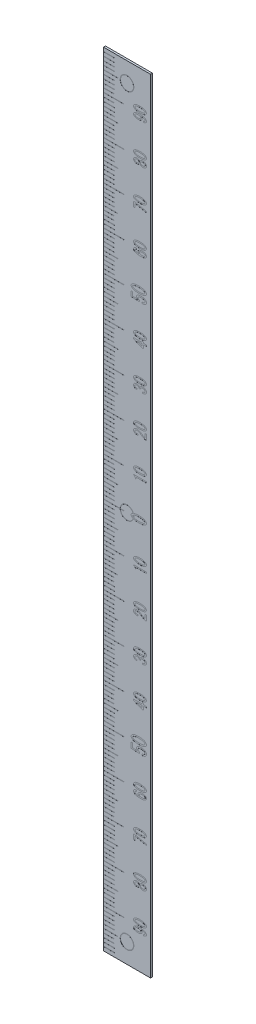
SolidWorks part; units mm, degrees
ref_plane "Front" through (0, 0, 0) normal (0, 0, 1) x (1, 0, 0)
ref_plane "Top" through (0, 0, 0) normal (0, 1, 0) x (1, 0, 0)
ref_plane "Right" through (0, 0, 0) normal (1, 0, 0) x (0, 0, -1)
sketch "Sketch1" plane through (0, 0, 0) normal (0, 0, 1) x (1, 0, 0)
  line L1 (0, 0) -> (0, 200)
  line L2 (0, 0) -> (12, 0)
  line L3 (12, 0) -> (12, 200)
  line L4 (0, 200) -> (12, 200)
  dimension "D1" = 200
  dimension "D2" = 12
extrude "Extrude1" add sketch "Sketch1" along normal blind 0.5
sketch "Sketch2" plane through (0, 0, 0.5) normal (0, 0, 1) x (1, 0, 0)
  line L0 (0, 200) -> (0, 0) construction
  line L1 (0, 0) -> (12, 0) construction
  line L2 (12, 200) -> (0, 200) construction
  circle A0 centre (6, 5) radius 1.75
  circle A1 centre (6, 195) radius 1.75
  circle A2 centre (6, 5) radius 1.65
  circle A3 centre (6, 195) radius 1.65
  circle A4 centre (6, 100) radius 1.75
  circle A5 centre (6, 100) radius 1.65
  dimension "D1" = 6
  dimension "D2" = 6
  dimension "D3" = 5
  dimension "D4" = 5
  dimension "D5" = 3.5
  dimension "D6" = 3.5
  dimension "D7" = 0.1
  dimension "D8" = 2
extrude "Extrude2" cut sketch "Sketch2" against normal blind 0.01
sketch "Sketch3" plane through (0, 0, 0.5) normal (0, 0, 1) x (1, 0, 0)
  line L0 (7.5, 188.25) -> (11, 188.25) construction
  line L1 (7.5, 138.25) -> (11, 138.25) construction
  line L2 (7.5, 138.25) -> (7.5, 141.75) construction
  line L3 (7.5, 141.75) -> (11, 141.75) construction
  line L4 (11, 138.25) -> (11, 141.75) construction
  line L6 (11, 128.25) -> (11, 131.75) construction
  line L7 (11, 118.25) -> (11, 121.75) construction
  line L8 (11, 108.25) -> (11, 111.75) construction
  line L9 (11, 97.2) -> (11, 102.8) construction
  line L10 (11, 88.25) -> (11, 91.75) construction
  line L11 (11, 78.25) -> (11, 81.75) construction
  line L12 (11, 68.25) -> (11, 71.75) construction
  line L13 (11, 58.25) -> (11, 61.75) construction
  line L14 (11, 48) -> (11, 52) construction
  line L15 (11, 38.25) -> (11, 43.5) construction
  line L16 (11, 110) -> (-4.9003, 110) construction
  line L17 (11, 50) -> (-4.9003, 50) construction
  line L18 (11, 28.25) -> (11, 33.5) construction
  line L19 (11, 18.25) -> (11, 23.5) construction
  line L20 (11, 8.25) -> (11, 13.5) construction
  line L21 (11, 100) -> (-4.9003, 100) construction
  line L22 (11, 120) -> (-4.9003, 120) construction
  line L23 (11, 130) -> (-4.9003, 130) construction
  line L24 (11, 140) -> (-4.9003, 140) construction
  line L25 (7.5, 188.25) -> (7.5, 191.75) construction
  line L26 (7.5, 191.75) -> (11, 191.75) construction
  line L27 (11, 188.25) -> (11, 191.75) construction
  line L28 (11, 178.25) -> (11, 181.75) construction
  line L29 (11, 168.25) -> (11, 171.75) construction
  line L30 (11, 158.25) -> (11, 161.75) construction
  line L31 (11, 148) -> (11, 152.8) construction
  line L32 (4.5, 160) -> (-4.9003, 160) construction
  line L33 (4.5, 150) -> (-4.9003, 150) construction
  line L34 (4.5, 170) -> (-4.9003, 170) construction
  line L35 (4.5, 180) -> (-4.9003, 180) construction
  line L36 (4.5, 190) -> (-4.9003, 190) construction
  line L37 (11, 40) -> (-4.9003, 40) construction
  line L38 (11, 30) -> (-4.9003, 30) construction
  line L39 (11, 20) -> (-4.9003, 20) construction
  line L40 (11, 10) -> (-4.9003, 10) construction
  line L41 (12, 0) -> (12, 200) construction
  line L42 (11, 90) -> (-4.9003, 90) construction
  text T0 "40" font "ＭＳ ゴシック" height in points 11
  text T1 "30" font "ＭＳ ゴシック" height in points 11
  text T2 "20" font "ＭＳ ゴシック" height in points 11
  text T3 "10" font "ＭＳ ゴシック" height in points 11
  text T4 " 0 " font "ＭＳ ゴシック" height in points 13
  text T5 "10" font "ＭＳ ゴシック" height in points 11
  text T6 "20" font "ＭＳ ゴシック" height in points 11
  text T7 "30" font "ＭＳ ゴシック" height in points 11
  text T8 "40" font "ＭＳ ゴシック" height in points 11
  text T9 "50" font "ＭＳ ゴシック" height in points 13
  text T10 "60" font "ＭＳ ゴシック" height in points 11
  text T11 "70" font "ＭＳ ゴシック" height in points 11
  text T12 "80" font "ＭＳ ゴシック" height in points 11
  text T13 "90" font "ＭＳ ゴシック" height in points 11
  text T14 "50" font "ＭＳ ゴシック" height in points 13
  text T15 "60" font "ＭＳ ゴシック" height in points 11
  text T16 "70" font "ＭＳ ゴシック" height in points 11
  text T17 "80" font "ＭＳ ゴシック" height in points 11
  text T18 "90" font "ＭＳ ゴシック" height in points 11
  point P19 (11, 100)
  dimension "D1" = 3.5
  dimension "D2" = 1.75
  dimension "D4" = 3.5
  dimension "D8" = 4
  dimension "D9" = 50
  dimension "D10" = 2
  dimension "D11" = 5.6
  dimension "D12" = 1.75
  dimension "D5" = 3.5
  dimension "D13" = 1.75
  dimension "D14" = 1.75
  dimension "D15" = 1
  dimension "D16" = 1.75
  dimension "D17" = 1.75
  dimension "D18" = 1.75
  dimension "D19" = 1.75
  dimension "D20" = 1
  dimension "D21" = 1
  dimension "D23" = 1.75
  dimension "D24" = 2
  dimension "D25" = 1.75
  dimension "D26" = 1.75
  dimension "D27" = 1.75
  dimension "D28" = 1.75
  dimension "D29" = 1
  dimension "D6" = 5
  dimension "D7" = 5
  dimension "D22" = 2
extrude "Extrude3" cut sketch "Sketch3" against normal blind 0.01
sketch "Sketch4" plane through (0, 0, 0.5) normal (0, 0, 1) x (1, 0, 0)
  line L806 (5.8733, 199.8158) -> (5.8733, 186.95) construction
  line L807 (2.7465, 1.05) -> (2.7465, 0.95)
  line L808 (-0.2535, 0.95) -> (2.7465, 0.95)
  line L809 (-0.2535, 1.05) -> (2.7465, 1.05)
  line L810 (-0.2535, 1.05) -> (-0.2535, 0.95)
  line L811 (2.7465, 2.05) -> (2.7465, 1.95)
  line L812 (-0.2535, 1.95) -> (2.7465, 1.95)
  line L813 (-0.2535, 2.05) -> (2.7465, 2.05)
  line L814 (-0.2535, 2.05) -> (-0.2535, 1.95)
  line L815 (2.7465, 3.05) -> (2.7465, 2.95)
  line L816 (-0.2535, 2.95) -> (2.7465, 2.95)
  line L817 (-0.2535, 3.05) -> (2.7465, 3.05)
  line L818 (-0.2535, 3.05) -> (-0.2535, 2.95)
  line L819 (2.7465, 4.05) -> (2.7465, 3.95)
  line L820 (-0.2535, 3.95) -> (2.7465, 3.95)
  line L821 (-0.2535, 4.05) -> (2.7465, 4.05)
  line L822 (-0.2535, 4.05) -> (-0.2535, 3.95)
  line L823 (2.7465, 6.05) -> (2.7465, 5.95)
  line L824 (-0.2535, 5.95) -> (2.7465, 5.95)
  line L825 (-0.2535, 6.05) -> (2.7465, 6.05)
  line L826 (-0.2535, 6.05) -> (-0.2535, 5.95)
  line L827 (2.7465, 7.05) -> (2.7465, 6.95)
  line L828 (-0.2535, 6.95) -> (2.7465, 6.95)
  line L829 (-0.2535, 7.05) -> (2.7465, 7.05)
  line L830 (-0.2535, 7.05) -> (-0.2535, 6.95)
  line L831 (2.7465, 8.05) -> (2.7465, 7.95)
  line L832 (-0.2535, 7.95) -> (2.7465, 7.95)
  line L833 (-0.2535, 8.05) -> (2.7465, 8.05)
  line L834 (2.7465, 9.05) -> (2.7465, 8.95)
  line L835 (-0.2535, 8.95) -> (2.7465, 8.95)
  line L836 (-0.2535, 9.05) -> (-0.2535, 8.95)
  line L837 (-0.2535, 9.05) -> (2.7465, 9.05)
  line L838 (3.7465, 4.95) -> (3.7465, 5.05)
  line L839 (-0.2535, 5.05) -> (3.7465, 5.05)
  line L840 (-0.2535, 4.95) -> (-0.2535, 5.05)
  line L841 (-0.2535, 4.95) -> (3.7465, 4.95)
  line L842 (-0.2535, 8.05) -> (-0.2535, 7.95)
  line L843 (-0.2535, 9.95) -> (-0.2535, 10.05)
  line L844 (5.2465, 9.95) -> (-0.2535, 9.95)
  line L845 (5.2465, 10.05) -> (5.2465, 9.95)
  line L846 (-0.2535, 10.05) -> (5.2465, 10.05)
  line L847 (2.7465, 11.05) -> (2.7465, 10.95)
  line L848 (-0.2535, 10.95) -> (2.7465, 10.95)
  line L849 (-0.2535, 11.05) -> (2.7465, 11.05)
  line L850 (-0.2535, 11.05) -> (-0.2535, 10.95)
  line L851 (2.7465, 12.05) -> (2.7465, 11.95)
  line L852 (-0.2535, 11.95) -> (2.7465, 11.95)
  line L853 (-0.2535, 12.05) -> (2.7465, 12.05)
  line L854 (-0.2535, 12.05) -> (-0.2535, 11.95)
  line L855 (2.7465, 13.05) -> (2.7465, 12.95)
  line L856 (-0.2535, 12.95) -> (2.7465, 12.95)
  line L857 (-0.2535, 13.05) -> (2.7465, 13.05)
  line L858 (-0.2535, 13.05) -> (-0.2535, 12.95)
  line L859 (2.7465, 14.05) -> (2.7465, 13.95)
  line L860 (-0.2535, 13.95) -> (2.7465, 13.95)
  line L861 (-0.2535, 14.05) -> (2.7465, 14.05)
  line L862 (-0.2535, 14.05) -> (-0.2535, 13.95)
  line L863 (2.7465, 16.05) -> (2.7465, 15.95)
  line L864 (-0.2535, 15.95) -> (2.7465, 15.95)
  line L865 (-0.2535, 16.05) -> (2.7465, 16.05)
  line L866 (-0.2535, 16.05) -> (-0.2535, 15.95)
  line L867 (2.7465, 17.05) -> (2.7465, 16.95)
  line L868 (-0.2535, 16.95) -> (2.7465, 16.95)
  line L869 (-0.2535, 17.05) -> (2.7465, 17.05)
  line L870 (-0.2535, 17.05) -> (-0.2535, 16.95)
  line L871 (2.7465, 18.05) -> (2.7465, 17.95)
  line L872 (-0.2535, 17.95) -> (2.7465, 17.95)
  line L873 (-0.2535, 18.05) -> (2.7465, 18.05)
  line L874 (2.7465, 19.05) -> (2.7465, 18.95)
  line L875 (-0.2535, 18.95) -> (2.7465, 18.95)
  line L876 (-0.2535, 19.05) -> (-0.2535, 18.95)
  line L877 (-0.2535, 19.05) -> (2.7465, 19.05)
  line L878 (3.7465, 14.95) -> (3.7465, 15.05)
  line L879 (-0.2535, 15.05) -> (3.7465, 15.05)
  line L880 (-0.2535, 14.95) -> (-0.2535, 15.05)
  line L881 (-0.2535, 14.95) -> (3.7465, 14.95)
  line L882 (-0.2535, 18.05) -> (-0.2535, 17.95)
  line L883 (-0.2535, 19.95) -> (-0.2535, 20.05)
  line L884 (5.2465, 19.95) -> (-0.2535, 19.95)
  line L885 (5.2465, 20.05) -> (5.2465, 19.95)
  line L886 (-0.2535, 20.05) -> (5.2465, 20.05)
  line L887 (2.7465, 21.05) -> (2.7465, 20.95)
  line L888 (-0.2535, 20.95) -> (2.7465, 20.95)
  line L889 (-0.2535, 21.05) -> (2.7465, 21.05)
  line L890 (-0.2535, 21.05) -> (-0.2535, 20.95)
  line L891 (2.7465, 22.05) -> (2.7465, 21.95)
  line L892 (-0.2535, 21.95) -> (2.7465, 21.95)
  line L893 (-0.2535, 22.05) -> (2.7465, 22.05)
  line L894 (-0.2535, 22.05) -> (-0.2535, 21.95)
  line L895 (2.7465, 23.05) -> (2.7465, 22.95)
  line L896 (-0.2535, 22.95) -> (2.7465, 22.95)
  line L897 (-0.2535, 23.05) -> (2.7465, 23.05)
  line L898 (-0.2535, 23.05) -> (-0.2535, 22.95)
  line L899 (2.7465, 24.05) -> (2.7465, 23.95)
  line L900 (-0.2535, 23.95) -> (2.7465, 23.95)
  line L901 (-0.2535, 24.05) -> (2.7465, 24.05)
  line L902 (-0.2535, 24.05) -> (-0.2535, 23.95)
  line L903 (2.7465, 26.05) -> (2.7465, 25.95)
  line L904 (-0.2535, 25.95) -> (2.7465, 25.95)
  line L905 (-0.2535, 26.05) -> (2.7465, 26.05)
  line L906 (-0.2535, 26.05) -> (-0.2535, 25.95)
  line L907 (2.7465, 27.05) -> (2.7465, 26.95)
  line L908 (-0.2535, 26.95) -> (2.7465, 26.95)
  line L909 (-0.2535, 27.05) -> (2.7465, 27.05)
  line L910 (-0.2535, 27.05) -> (-0.2535, 26.95)
  line L911 (2.7465, 28.05) -> (2.7465, 27.95)
  line L912 (-0.2535, 27.95) -> (2.7465, 27.95)
  line L913 (-0.2535, 28.05) -> (2.7465, 28.05)
  line L914 (2.7465, 29.05) -> (2.7465, 28.95)
  line L915 (-0.2535, 28.95) -> (2.7465, 28.95)
  line L916 (-0.2535, 29.05) -> (-0.2535, 28.95)
  line L917 (-0.2535, 29.05) -> (2.7465, 29.05)
  line L918 (3.7465, 24.95) -> (3.7465, 25.05)
  line L919 (-0.2535, 25.05) -> (3.7465, 25.05)
  line L920 (-0.2535, 24.95) -> (-0.2535, 25.05)
  line L921 (-0.2535, 24.95) -> (3.7465, 24.95)
  line L922 (-0.2535, 28.05) -> (-0.2535, 27.95)
  line L923 (-0.2535, 29.95) -> (-0.2535, 30.05)
  line L924 (5.2465, 29.95) -> (-0.2535, 29.95)
  line L925 (5.2465, 30.05) -> (5.2465, 29.95)
  line L926 (-0.2535, 30.05) -> (5.2465, 30.05)
  line L927 (2.7465, 31.05) -> (2.7465, 30.95)
  line L928 (-0.2535, 30.95) -> (2.7465, 30.95)
  line L929 (-0.2535, 31.05) -> (2.7465, 31.05)
  line L930 (-0.2535, 31.05) -> (-0.2535, 30.95)
  line L931 (2.7465, 32.05) -> (2.7465, 31.95)
  line L932 (-0.2535, 31.95) -> (2.7465, 31.95)
  line L933 (-0.2535, 32.05) -> (2.7465, 32.05)
  line L934 (-0.2535, 32.05) -> (-0.2535, 31.95)
  line L935 (2.7465, 33.05) -> (2.7465, 32.95)
  line L936 (-0.2535, 32.95) -> (2.7465, 32.95)
  line L937 (-0.2535, 33.05) -> (2.7465, 33.05)
  line L938 (-0.2535, 33.05) -> (-0.2535, 32.95)
  line L939 (2.7465, 34.05) -> (2.7465, 33.95)
  line L940 (-0.2535, 33.95) -> (2.7465, 33.95)
  line L941 (-0.2535, 34.05) -> (2.7465, 34.05)
  line L942 (-0.2535, 34.05) -> (-0.2535, 33.95)
  line L943 (2.7465, 36.05) -> (2.7465, 35.95)
  line L944 (-0.2535, 35.95) -> (2.7465, 35.95)
  line L945 (-0.2535, 36.05) -> (2.7465, 36.05)
  line L946 (-0.2535, 36.05) -> (-0.2535, 35.95)
  line L947 (2.7465, 37.05) -> (2.7465, 36.95)
  line L948 (-0.2535, 36.95) -> (2.7465, 36.95)
  line L949 (-0.2535, 37.05) -> (2.7465, 37.05)
  line L950 (-0.2535, 37.05) -> (-0.2535, 36.95)
  line L951 (2.7465, 38.05) -> (2.7465, 37.95)
  line L952 (-0.2535, 37.95) -> (2.7465, 37.95)
  line L953 (-0.2535, 38.05) -> (2.7465, 38.05)
  line L954 (2.7465, 39.05) -> (2.7465, 38.95)
  line L955 (-0.2535, 38.95) -> (2.7465, 38.95)
  line L956 (-0.2535, 39.05) -> (-0.2535, 38.95)
  line L957 (-0.2535, 39.05) -> (2.7465, 39.05)
  line L958 (3.7465, 34.95) -> (3.7465, 35.05)
  line L959 (-0.2535, 35.05) -> (3.7465, 35.05)
  line L960 (-0.2535, 34.95) -> (-0.2535, 35.05)
  line L961 (-0.2535, 34.95) -> (3.7465, 34.95)
  line L962 (-0.2535, 38.05) -> (-0.2535, 37.95)
  line L963 (-0.2535, 39.95) -> (-0.2535, 40.05)
  line L964 (5.2465, 39.95) -> (-0.2535, 39.95)
  line L965 (5.2465, 40.05) -> (5.2465, 39.95)
  line L966 (-0.2535, 40.05) -> (5.2465, 40.05)
  line L967 (2.7465, 41.05) -> (2.7465, 40.95)
  line L968 (-0.2535, 40.95) -> (2.7465, 40.95)
  line L969 (-0.2535, 41.05) -> (2.7465, 41.05)
  line L970 (-0.2535, 41.05) -> (-0.2535, 40.95)
  line L971 (2.7465, 42.05) -> (2.7465, 41.95)
  line L972 (-0.2535, 41.95) -> (2.7465, 41.95)
  line L973 (-0.2535, 42.05) -> (2.7465, 42.05)
  line L974 (-0.2535, 42.05) -> (-0.2535, 41.95)
  line L975 (2.7465, 43.05) -> (2.7465, 42.95)
  line L976 (-0.2535, 42.95) -> (2.7465, 42.95)
  line L977 (-0.2535, 43.05) -> (2.7465, 43.05)
  line L978 (-0.2535, 43.05) -> (-0.2535, 42.95)
  line L979 (2.7465, 44.05) -> (2.7465, 43.95)
  line L980 (-0.2535, 43.95) -> (2.7465, 43.95)
  line L981 (-0.2535, 44.05) -> (2.7465, 44.05)
  line L982 (-0.2535, 44.05) -> (-0.2535, 43.95)
  line L983 (2.7465, 46.05) -> (2.7465, 45.95)
  line L984 (-0.2535, 45.95) -> (2.7465, 45.95)
  line L985 (-0.2535, 46.05) -> (2.7465, 46.05)
  line L986 (-0.2535, 46.05) -> (-0.2535, 45.95)
  line L987 (2.7465, 47.05) -> (2.7465, 46.95)
  line L988 (-0.2535, 46.95) -> (2.7465, 46.95)
  line L989 (-0.2535, 47.05) -> (2.7465, 47.05)
  line L990 (-0.2535, 47.05) -> (-0.2535, 46.95)
  line L991 (2.7465, 48.05) -> (2.7465, 47.95)
  line L992 (-0.2535, 47.95) -> (2.7465, 47.95)
  line L993 (-0.2535, 48.05) -> (2.7465, 48.05)
  line L994 (2.7465, 49.05) -> (2.7465, 48.95)
  line L995 (-0.2535, 48.95) -> (2.7465, 48.95)
  line L996 (-0.2535, 49.05) -> (-0.2535, 48.95)
  line L997 (-0.2535, 49.05) -> (2.7465, 49.05)
  line L998 (3.7465, 44.95) -> (3.7465, 45.05)
  line L999 (-0.2535, 45.05) -> (3.7465, 45.05)
  line L1000 (-0.2535, 44.95) -> (-0.2535, 45.05)
  line L1001 (-0.2535, 44.95) -> (3.7465, 44.95)
  line L1002 (-0.2535, 48.05) -> (-0.2535, 47.95)
  line L1003 (-0.2535, 49.95) -> (-0.2535, 50.05)
  line L1004 (5.2465, 49.95) -> (-0.2535, 49.95)
  line L1005 (5.2465, 50.05) -> (5.2465, 49.95)
  line L1006 (-0.2535, 50.05) -> (5.2465, 50.05)
  line L1007 (2.7465, 51.05) -> (2.7465, 50.95)
  line L1008 (-0.2535, 50.95) -> (2.7465, 50.95)
  line L1009 (-0.2535, 51.05) -> (2.7465, 51.05)
  line L1010 (-0.2535, 51.05) -> (-0.2535, 50.95)
  line L1011 (2.7465, 52.05) -> (2.7465, 51.95)
  line L1012 (-0.2535, 51.95) -> (2.7465, 51.95)
  line L1013 (-0.2535, 52.05) -> (2.7465, 52.05)
  line L1014 (-0.2535, 52.05) -> (-0.2535, 51.95)
  line L1015 (2.7465, 53.05) -> (2.7465, 52.95)
  line L1016 (-0.2535, 52.95) -> (2.7465, 52.95)
  line L1017 (-0.2535, 53.05) -> (2.7465, 53.05)
  line L1018 (-0.2535, 53.05) -> (-0.2535, 52.95)
  line L1019 (2.7465, 54.05) -> (2.7465, 53.95)
  line L1020 (-0.2535, 53.95) -> (2.7465, 53.95)
  line L1021 (-0.2535, 54.05) -> (2.7465, 54.05)
  line L1022 (-0.2535, 54.05) -> (-0.2535, 53.95)
  line L1023 (2.7465, 56.05) -> (2.7465, 55.95)
  line L1024 (-0.2535, 55.95) -> (2.7465, 55.95)
  line L1025 (-0.2535, 56.05) -> (2.7465, 56.05)
  line L1026 (-0.2535, 56.05) -> (-0.2535, 55.95)
  line L1027 (2.7465, 57.05) -> (2.7465, 56.95)
  line L1028 (-0.2535, 56.95) -> (2.7465, 56.95)
  line L1029 (-0.2535, 57.05) -> (2.7465, 57.05)
  line L1030 (-0.2535, 57.05) -> (-0.2535, 56.95)
  line L1031 (2.7465, 58.05) -> (2.7465, 57.95)
  line L1032 (-0.2535, 57.95) -> (2.7465, 57.95)
  line L1033 (-0.2535, 58.05) -> (2.7465, 58.05)
  line L1034 (2.7465, 59.05) -> (2.7465, 58.95)
  line L1035 (-0.2535, 58.95) -> (2.7465, 58.95)
  line L1036 (-0.2535, 59.05) -> (-0.2535, 58.95)
  line L1037 (-0.2535, 59.05) -> (2.7465, 59.05)
  line L1038 (3.7465, 54.95) -> (3.7465, 55.05)
  line L1039 (-0.2535, 55.05) -> (3.7465, 55.05)
  line L1040 (-0.2535, 54.95) -> (-0.2535, 55.05)
  line L1041 (-0.2535, 54.95) -> (3.7465, 54.95)
  line L1042 (-0.2535, 58.05) -> (-0.2535, 57.95)
  line L1043 (-0.2535, 59.95) -> (-0.2535, 60.05)
  line L1044 (5.2465, 59.95) -> (-0.2535, 59.95)
  line L1045 (5.2465, 60.05) -> (5.2465, 59.95)
  line L1046 (-0.2535, 60.05) -> (5.2465, 60.05)
  line L1047 (2.7465, 61.05) -> (2.7465, 60.95)
  line L1048 (-0.2535, 60.95) -> (2.7465, 60.95)
  line L1049 (-0.2535, 61.05) -> (2.7465, 61.05)
  line L1050 (-0.2535, 61.05) -> (-0.2535, 60.95)
  line L1051 (2.7465, 62.05) -> (2.7465, 61.95)
  line L1052 (-0.2535, 61.95) -> (2.7465, 61.95)
  line L1053 (-0.2535, 62.05) -> (2.7465, 62.05)
  line L1054 (-0.2535, 62.05) -> (-0.2535, 61.95)
  line L1055 (2.7465, 63.05) -> (2.7465, 62.95)
  line L1056 (-0.2535, 62.95) -> (2.7465, 62.95)
  line L1057 (-0.2535, 63.05) -> (2.7465, 63.05)
  line L1058 (-0.2535, 63.05) -> (-0.2535, 62.95)
  line L1059 (2.7465, 64.05) -> (2.7465, 63.95)
  line L1060 (-0.2535, 63.95) -> (2.7465, 63.95)
  line L1061 (-0.2535, 64.05) -> (2.7465, 64.05)
  line L1062 (-0.2535, 64.05) -> (-0.2535, 63.95)
  line L1063 (2.7465, 66.05) -> (2.7465, 65.95)
  line L1064 (-0.2535, 65.95) -> (2.7465, 65.95)
  line L1065 (-0.2535, 66.05) -> (2.7465, 66.05)
  line L1066 (-0.2535, 66.05) -> (-0.2535, 65.95)
  line L1067 (2.7465, 67.05) -> (2.7465, 66.95)
  line L1068 (-0.2535, 66.95) -> (2.7465, 66.95)
  line L1069 (-0.2535, 67.05) -> (2.7465, 67.05)
  line L1070 (-0.2535, 67.05) -> (-0.2535, 66.95)
  line L1071 (2.7465, 68.05) -> (2.7465, 67.95)
  line L1072 (-0.2535, 67.95) -> (2.7465, 67.95)
  line L1073 (-0.2535, 68.05) -> (2.7465, 68.05)
  line L1074 (2.7465, 69.05) -> (2.7465, 68.95)
  line L1075 (-0.2535, 68.95) -> (2.7465, 68.95)
  line L1076 (-0.2535, 69.05) -> (-0.2535, 68.95)
  line L1077 (-0.2535, 69.05) -> (2.7465, 69.05)
  line L1078 (3.7465, 64.95) -> (3.7465, 65.05)
  line L1079 (-0.2535, 65.05) -> (3.7465, 65.05)
  line L1080 (-0.2535, 64.95) -> (-0.2535, 65.05)
  line L1081 (-0.2535, 64.95) -> (3.7465, 64.95)
  line L1082 (-0.2535, 68.05) -> (-0.2535, 67.95)
  line L1083 (-0.2535, 69.95) -> (-0.2535, 70.05)
  line L1084 (5.2465, 69.95) -> (-0.2535, 69.95)
  line L1085 (5.2465, 70.05) -> (5.2465, 69.95)
  line L1086 (-0.2535, 70.05) -> (5.2465, 70.05)
  line L1087 (2.7465, 71.05) -> (2.7465, 70.95)
  line L1088 (-0.2535, 70.95) -> (2.7465, 70.95)
  line L1089 (-0.2535, 71.05) -> (2.7465, 71.05)
  line L1090 (-0.2535, 71.05) -> (-0.2535, 70.95)
  line L1091 (2.7465, 72.05) -> (2.7465, 71.95)
  line L1092 (-0.2535, 71.95) -> (2.7465, 71.95)
  line L1093 (-0.2535, 72.05) -> (2.7465, 72.05)
  line L1094 (-0.2535, 72.05) -> (-0.2535, 71.95)
  line L1095 (2.7465, 73.05) -> (2.7465, 72.95)
  line L1096 (-0.2535, 72.95) -> (2.7465, 72.95)
  line L1097 (-0.2535, 73.05) -> (2.7465, 73.05)
  line L1098 (-0.2535, 73.05) -> (-0.2535, 72.95)
  line L1099 (2.7465, 74.05) -> (2.7465, 73.95)
  line L1100 (-0.2535, 73.95) -> (2.7465, 73.95)
  line L1101 (-0.2535, 74.05) -> (2.7465, 74.05)
  line L1102 (-0.2535, 74.05) -> (-0.2535, 73.95)
  line L1103 (2.7465, 76.05) -> (2.7465, 75.95)
  line L1104 (-0.2535, 75.95) -> (2.7465, 75.95)
  line L1105 (-0.2535, 76.05) -> (2.7465, 76.05)
  line L1106 (-0.2535, 76.05) -> (-0.2535, 75.95)
  line L1107 (2.7465, 77.05) -> (2.7465, 76.95)
  line L1108 (-0.2535, 76.95) -> (2.7465, 76.95)
  line L1109 (-0.2535, 77.05) -> (2.7465, 77.05)
  line L1110 (-0.2535, 77.05) -> (-0.2535, 76.95)
  line L1111 (2.7465, 78.05) -> (2.7465, 77.95)
  line L1112 (-0.2535, 77.95) -> (2.7465, 77.95)
  line L1113 (-0.2535, 78.05) -> (2.7465, 78.05)
  line L1114 (2.7465, 79.05) -> (2.7465, 78.95)
  line L1115 (-0.2535, 78.95) -> (2.7465, 78.95)
  line L1116 (-0.2535, 79.05) -> (-0.2535, 78.95)
  line L1117 (-0.2535, 79.05) -> (2.7465, 79.05)
  line L1118 (3.7465, 74.95) -> (3.7465, 75.05)
  line L1119 (-0.2535, 75.05) -> (3.7465, 75.05)
  line L1120 (-0.2535, 74.95) -> (-0.2535, 75.05)
  line L1121 (-0.2535, 74.95) -> (3.7465, 74.95)
  line L1122 (-0.2535, 78.05) -> (-0.2535, 77.95)
  line L1123 (-0.2535, 79.95) -> (-0.2535, 80.05)
  line L1124 (5.2465, 79.95) -> (-0.2535, 79.95)
  line L1125 (5.2465, 80.05) -> (5.2465, 79.95)
  line L1126 (-0.2535, 80.05) -> (5.2465, 80.05)
  line L1127 (2.7465, 81.05) -> (2.7465, 80.95)
  line L1128 (-0.2535, 80.95) -> (2.7465, 80.95)
  line L1129 (-0.2535, 81.05) -> (2.7465, 81.05)
  line L1130 (-0.2535, 81.05) -> (-0.2535, 80.95)
  line L1131 (2.7465, 82.05) -> (2.7465, 81.95)
  line L1132 (-0.2535, 81.95) -> (2.7465, 81.95)
  line L1133 (-0.2535, 82.05) -> (2.7465, 82.05)
  line L1134 (-0.2535, 82.05) -> (-0.2535, 81.95)
  line L1135 (2.7465, 83.05) -> (2.7465, 82.95)
  line L1136 (-0.2535, 82.95) -> (2.7465, 82.95)
  line L1137 (-0.2535, 83.05) -> (2.7465, 83.05)
  line L1138 (-0.2535, 83.05) -> (-0.2535, 82.95)
  line L1139 (2.7465, 84.05) -> (2.7465, 83.95)
  line L1140 (-0.2535, 83.95) -> (2.7465, 83.95)
  line L1141 (-0.2535, 84.05) -> (2.7465, 84.05)
  line L1142 (-0.2535, 84.05) -> (-0.2535, 83.95)
  line L1143 (2.7465, 86.05) -> (2.7465, 85.95)
  line L1144 (-0.2535, 85.95) -> (2.7465, 85.95)
  line L1145 (-0.2535, 86.05) -> (2.7465, 86.05)
  line L1146 (-0.2535, 86.05) -> (-0.2535, 85.95)
  line L1147 (2.7465, 87.05) -> (2.7465, 86.95)
  line L1148 (-0.2535, 86.95) -> (2.7465, 86.95)
  line L1149 (-0.2535, 87.05) -> (2.7465, 87.05)
  line L1150 (-0.2535, 87.05) -> (-0.2535, 86.95)
  line L1151 (2.7465, 88.05) -> (2.7465, 87.95)
  line L1152 (-0.2535, 87.95) -> (2.7465, 87.95)
  line L1153 (-0.2535, 88.05) -> (2.7465, 88.05)
  line L1154 (2.7465, 89.05) -> (2.7465, 88.95)
  line L1155 (-0.2535, 88.95) -> (2.7465, 88.95)
  line L1156 (-0.2535, 89.05) -> (-0.2535, 88.95)
  line L1157 (-0.2535, 89.05) -> (2.7465, 89.05)
  line L1158 (3.7465, 84.95) -> (3.7465, 85.05)
  line L1159 (-0.2535, 85.05) -> (3.7465, 85.05)
  line L1160 (-0.2535, 84.95) -> (-0.2535, 85.05)
  line L1161 (-0.2535, 84.95) -> (3.7465, 84.95)
  line L1162 (-0.2535, 88.05) -> (-0.2535, 87.95)
  line L1163 (-0.2535, 89.95) -> (-0.2535, 90.05)
  line L1164 (5.2465, 89.95) -> (-0.2535, 89.95)
  line L1165 (5.2465, 90.05) -> (5.2465, 89.95)
  line L1166 (-0.2535, 90.05) -> (5.2465, 90.05)
  line L1167 (2.7465, 91.05) -> (2.7465, 90.95)
  line L1168 (-0.2535, 90.95) -> (2.7465, 90.95)
  line L1169 (-0.2535, 91.05) -> (2.7465, 91.05)
  line L1170 (-0.2535, 91.05) -> (-0.2535, 90.95)
  line L1171 (2.7465, 92.05) -> (2.7465, 91.95)
  line L1172 (-0.2535, 91.95) -> (2.7465, 91.95)
  line L1173 (-0.2535, 92.05) -> (2.7465, 92.05)
  line L1174 (-0.2535, 92.05) -> (-0.2535, 91.95)
  line L1175 (2.7465, 93.05) -> (2.7465, 92.95)
  line L1176 (-0.2535, 92.95) -> (2.7465, 92.95)
  line L1177 (-0.2535, 93.05) -> (2.7465, 93.05)
  line L1178 (-0.2535, 93.05) -> (-0.2535, 92.95)
  line L1179 (2.7465, 94.05) -> (2.7465, 93.95)
  line L1180 (-0.2535, 93.95) -> (2.7465, 93.95)
  line L1181 (-0.2535, 94.05) -> (2.7465, 94.05)
  line L1182 (-0.2535, 94.05) -> (-0.2535, 93.95)
  line L1183 (2.7465, 96.05) -> (2.7465, 95.95)
  line L1184 (-0.2535, 95.95) -> (2.7465, 95.95)
  line L1185 (-0.2535, 96.05) -> (2.7465, 96.05)
  line L1186 (-0.2535, 96.05) -> (-0.2535, 95.95)
  line L1187 (2.7465, 97.05) -> (2.7465, 96.95)
  line L1188 (-0.2535, 96.95) -> (2.7465, 96.95)
  line L1189 (-0.2535, 97.05) -> (2.7465, 97.05)
  line L1190 (-0.2535, 97.05) -> (-0.2535, 96.95)
  line L1191 (2.7465, 98.05) -> (2.7465, 97.95)
  line L1192 (-0.2535, 97.95) -> (2.7465, 97.95)
  line L1193 (-0.2535, 98.05) -> (2.7465, 98.05)
  line L1194 (2.7465, 99.05) -> (2.7465, 98.95)
  line L1195 (-0.2535, 98.95) -> (2.7465, 98.95)
  line L1196 (-0.2535, 99.05) -> (-0.2535, 98.95)
  line L1197 (-0.2535, 99.05) -> (2.7465, 99.05)
  line L1198 (3.7465, 94.95) -> (3.7465, 95.05)
  line L1199 (-0.2535, 95.05) -> (3.7465, 95.05)
  line L1200 (-0.2535, 94.95) -> (-0.2535, 95.05)
  line L1201 (-0.2535, 94.95) -> (3.7465, 94.95)
  line L1202 (-0.2535, 98.05) -> (-0.2535, 97.95)
  line L1203 (-0.2535, 99.95) -> (-0.2535, 100.05)
  line L1204 (5.2465, 99.95) -> (-0.2535, 99.95)
  line L1205 (5.2465, 100.05) -> (5.2465, 99.95)
  line L1206 (-0.2535, 100.05) -> (5.2465, 100.05)
  line L1207 (2.7465, 101.05) -> (2.7465, 100.95)
  line L1208 (-0.2535, 100.95) -> (2.7465, 100.95)
  line L1209 (-0.2535, 101.05) -> (2.7465, 101.05)
  line L1210 (-0.2535, 101.05) -> (-0.2535, 100.95)
  line L1211 (2.7465, 102.05) -> (2.7465, 101.95)
  line L1212 (-0.2535, 101.95) -> (2.7465, 101.95)
  line L1213 (-0.2535, 102.05) -> (2.7465, 102.05)
  line L1214 (-0.2535, 102.05) -> (-0.2535, 101.95)
  line L1215 (2.7465, 103.05) -> (2.7465, 102.95)
  line L1216 (-0.2535, 102.95) -> (2.7465, 102.95)
  line L1217 (-0.2535, 103.05) -> (2.7465, 103.05)
  line L1218 (-0.2535, 103.05) -> (-0.2535, 102.95)
  line L1219 (2.7465, 104.05) -> (2.7465, 103.95)
  line L1220 (-0.2535, 103.95) -> (2.7465, 103.95)
  line L1221 (-0.2535, 104.05) -> (2.7465, 104.05)
  line L1222 (-0.2535, 104.05) -> (-0.2535, 103.95)
  line L1223 (2.7465, 106.05) -> (2.7465, 105.95)
  line L1224 (-0.2535, 105.95) -> (2.7465, 105.95)
  line L1225 (-0.2535, 106.05) -> (2.7465, 106.05)
  line L1226 (-0.2535, 106.05) -> (-0.2535, 105.95)
  line L1227 (2.7465, 107.05) -> (2.7465, 106.95)
  line L1228 (-0.2535, 106.95) -> (2.7465, 106.95)
  line L1229 (-0.2535, 107.05) -> (2.7465, 107.05)
  line L1230 (-0.2535, 107.05) -> (-0.2535, 106.95)
  line L1231 (2.7465, 108.05) -> (2.7465, 107.95)
  line L1232 (-0.2535, 107.95) -> (2.7465, 107.95)
  line L1233 (-0.2535, 108.05) -> (2.7465, 108.05)
  line L1234 (2.7465, 109.05) -> (2.7465, 108.95)
  line L1235 (-0.2535, 108.95) -> (2.7465, 108.95)
  line L1236 (-0.2535, 109.05) -> (-0.2535, 108.95)
  line L1237 (-0.2535, 109.05) -> (2.7465, 109.05)
  line L1238 (3.7465, 104.95) -> (3.7465, 105.05)
  line L1239 (-0.2535, 105.05) -> (3.7465, 105.05)
  line L1240 (-0.2535, 104.95) -> (-0.2535, 105.05)
  line L1241 (-0.2535, 104.95) -> (3.7465, 104.95)
  line L1242 (-0.2535, 108.05) -> (-0.2535, 107.95)
  line L1243 (-0.2535, 109.95) -> (-0.2535, 110.05)
  line L1244 (5.2465, 109.95) -> (-0.2535, 109.95)
  line L1245 (5.2465, 110.05) -> (5.2465, 109.95)
  line L1246 (-0.2535, 110.05) -> (5.2465, 110.05)
  line L1247 (2.7465, 111.05) -> (2.7465, 110.95)
  line L1248 (-0.2535, 110.95) -> (2.7465, 110.95)
  line L1249 (-0.2535, 111.05) -> (2.7465, 111.05)
  line L1250 (-0.2535, 111.05) -> (-0.2535, 110.95)
  line L1251 (2.7465, 112.05) -> (2.7465, 111.95)
  line L1252 (-0.2535, 111.95) -> (2.7465, 111.95)
  line L1253 (-0.2535, 112.05) -> (2.7465, 112.05)
  line L1254 (-0.2535, 112.05) -> (-0.2535, 111.95)
  line L1255 (2.7465, 113.05) -> (2.7465, 112.95)
  line L1256 (-0.2535, 112.95) -> (2.7465, 112.95)
  line L1257 (-0.2535, 113.05) -> (2.7465, 113.05)
  line L1258 (-0.2535, 113.05) -> (-0.2535, 112.95)
  line L1259 (2.7465, 114.05) -> (2.7465, 113.95)
  line L1260 (-0.2535, 113.95) -> (2.7465, 113.95)
  line L1261 (-0.2535, 114.05) -> (2.7465, 114.05)
  line L1262 (-0.2535, 114.05) -> (-0.2535, 113.95)
  line L1263 (2.7465, 116.05) -> (2.7465, 115.95)
  line L1264 (-0.2535, 115.95) -> (2.7465, 115.95)
  line L1265 (-0.2535, 116.05) -> (2.7465, 116.05)
  line L1266 (-0.2535, 116.05) -> (-0.2535, 115.95)
  line L1267 (2.7465, 117.05) -> (2.7465, 116.95)
  line L1268 (-0.2535, 116.95) -> (2.7465, 116.95)
  line L1269 (-0.2535, 117.05) -> (2.7465, 117.05)
  line L1270 (-0.2535, 117.05) -> (-0.2535, 116.95)
  line L1271 (2.7465, 118.05) -> (2.7465, 117.95)
  line L1272 (-0.2535, 117.95) -> (2.7465, 117.95)
  line L1273 (-0.2535, 118.05) -> (2.7465, 118.05)
  line L1274 (2.7465, 119.05) -> (2.7465, 118.95)
  line L1275 (-0.2535, 118.95) -> (2.7465, 118.95)
  line L1276 (-0.2535, 119.05) -> (-0.2535, 118.95)
  line L1277 (-0.2535, 119.05) -> (2.7465, 119.05)
  line L1278 (3.7465, 114.95) -> (3.7465, 115.05)
  line L1279 (-0.2535, 115.05) -> (3.7465, 115.05)
  line L1280 (-0.2535, 114.95) -> (-0.2535, 115.05)
  line L1281 (-0.2535, 114.95) -> (3.7465, 114.95)
  line L1282 (-0.2535, 118.05) -> (-0.2535, 117.95)
  line L1283 (-0.2535, 119.95) -> (-0.2535, 120.05)
  line L1284 (5.2465, 119.95) -> (-0.2535, 119.95)
  line L1285 (5.2465, 120.05) -> (5.2465, 119.95)
  line L1286 (-0.2535, 120.05) -> (5.2465, 120.05)
  line L1287 (2.7465, 121.05) -> (2.7465, 120.95)
  line L1288 (-0.2535, 120.95) -> (2.7465, 120.95)
  line L1289 (-0.2535, 121.05) -> (2.7465, 121.05)
  line L1290 (-0.2535, 121.05) -> (-0.2535, 120.95)
  line L1291 (2.7465, 122.05) -> (2.7465, 121.95)
  line L1292 (-0.2535, 121.95) -> (2.7465, 121.95)
  line L1293 (-0.2535, 122.05) -> (2.7465, 122.05)
  line L1294 (-0.2535, 122.05) -> (-0.2535, 121.95)
  line L1295 (2.7465, 123.05) -> (2.7465, 122.95)
  line L1296 (-0.2535, 122.95) -> (2.7465, 122.95)
  line L1297 (-0.2535, 123.05) -> (2.7465, 123.05)
  line L1298 (-0.2535, 123.05) -> (-0.2535, 122.95)
  line L1299 (2.7465, 124.05) -> (2.7465, 123.95)
  line L1300 (-0.2535, 123.95) -> (2.7465, 123.95)
  line L1301 (-0.2535, 124.05) -> (2.7465, 124.05)
  line L1302 (-0.2535, 124.05) -> (-0.2535, 123.95)
  line L1303 (2.7465, 126.05) -> (2.7465, 125.95)
  line L1304 (-0.2535, 125.95) -> (2.7465, 125.95)
  line L1305 (-0.2535, 126.05) -> (2.7465, 126.05)
  line L1306 (-0.2535, 126.05) -> (-0.2535, 125.95)
  line L1307 (2.7465, 127.05) -> (2.7465, 126.95)
  line L1308 (-0.2535, 126.95) -> (2.7465, 126.95)
  line L1309 (-0.2535, 127.05) -> (2.7465, 127.05)
  line L1310 (-0.2535, 127.05) -> (-0.2535, 126.95)
  line L1311 (2.7465, 128.05) -> (2.7465, 127.95)
  line L1312 (-0.2535, 127.95) -> (2.7465, 127.95)
  line L1313 (-0.2535, 128.05) -> (2.7465, 128.05)
  line L1314 (2.7465, 129.05) -> (2.7465, 128.95)
  line L1315 (-0.2535, 128.95) -> (2.7465, 128.95)
  line L1316 (-0.2535, 129.05) -> (-0.2535, 128.95)
  line L1317 (-0.2535, 129.05) -> (2.7465, 129.05)
  line L1318 (3.7465, 124.95) -> (3.7465, 125.05)
  line L1319 (-0.2535, 125.05) -> (3.7465, 125.05)
  line L1320 (-0.2535, 124.95) -> (-0.2535, 125.05)
  line L1321 (-0.2535, 124.95) -> (3.7465, 124.95)
  line L1322 (-0.2535, 128.05) -> (-0.2535, 127.95)
  line L1323 (-0.2535, 129.95) -> (-0.2535, 130.05)
  line L1324 (5.2465, 129.95) -> (-0.2535, 129.95)
  line L1325 (5.2465, 130.05) -> (5.2465, 129.95)
  line L1326 (-0.2535, 130.05) -> (5.2465, 130.05)
  line L1327 (2.7465, 131.05) -> (2.7465, 130.95)
  line L1328 (-0.2535, 130.95) -> (2.7465, 130.95)
  line L1329 (-0.2535, 131.05) -> (2.7465, 131.05)
  line L1330 (-0.2535, 131.05) -> (-0.2535, 130.95)
  line L1331 (2.7465, 132.05) -> (2.7465, 131.95)
  line L1332 (-0.2535, 131.95) -> (2.7465, 131.95)
  line L1333 (-0.2535, 132.05) -> (2.7465, 132.05)
  line L1334 (-0.2535, 132.05) -> (-0.2535, 131.95)
  line L1335 (2.7465, 133.05) -> (2.7465, 132.95)
  line L1336 (-0.2535, 132.95) -> (2.7465, 132.95)
  line L1337 (-0.2535, 133.05) -> (2.7465, 133.05)
  line L1338 (-0.2535, 133.05) -> (-0.2535, 132.95)
  line L1339 (2.7465, 134.05) -> (2.7465, 133.95)
  line L1340 (-0.2535, 133.95) -> (2.7465, 133.95)
  line L1341 (-0.2535, 134.05) -> (2.7465, 134.05)
  line L1342 (-0.2535, 134.05) -> (-0.2535, 133.95)
  line L1343 (2.7465, 136.05) -> (2.7465, 135.95)
  line L1344 (-0.2535, 135.95) -> (2.7465, 135.95)
  line L1345 (-0.2535, 136.05) -> (2.7465, 136.05)
  line L1346 (-0.2535, 136.05) -> (-0.2535, 135.95)
  line L1347 (2.7465, 137.05) -> (2.7465, 136.95)
  line L1348 (-0.2535, 136.95) -> (2.7465, 136.95)
  line L1349 (-0.2535, 137.05) -> (2.7465, 137.05)
  line L1350 (-0.2535, 137.05) -> (-0.2535, 136.95)
  line L1351 (2.7465, 138.05) -> (2.7465, 137.95)
  line L1352 (-0.2535, 137.95) -> (2.7465, 137.95)
  line L1353 (-0.2535, 138.05) -> (2.7465, 138.05)
  line L1354 (2.7465, 139.05) -> (2.7465, 138.95)
  line L1355 (-0.2535, 138.95) -> (2.7465, 138.95)
  line L1356 (-0.2535, 139.05) -> (-0.2535, 138.95)
  line L1357 (-0.2535, 139.05) -> (2.7465, 139.05)
  line L1358 (3.7465, 134.95) -> (3.7465, 135.05)
  line L1359 (-0.2535, 135.05) -> (3.7465, 135.05)
  line L1360 (-0.2535, 134.95) -> (-0.2535, 135.05)
  line L1361 (-0.2535, 134.95) -> (3.7465, 134.95)
  line L1362 (-0.2535, 138.05) -> (-0.2535, 137.95)
  line L1363 (-0.2535, 139.95) -> (-0.2535, 140.05)
  line L1364 (5.2465, 139.95) -> (-0.2535, 139.95)
  line L1365 (5.2465, 140.05) -> (5.2465, 139.95)
  line L1366 (-0.2535, 140.05) -> (5.2465, 140.05)
  line L1367 (2.7465, 141.05) -> (2.7465, 140.95)
  line L1368 (-0.2535, 140.95) -> (2.7465, 140.95)
  line L1369 (-0.2535, 141.05) -> (2.7465, 141.05)
  line L1370 (-0.2535, 141.05) -> (-0.2535, 140.95)
  line L1371 (2.7465, 142.05) -> (2.7465, 141.95)
  line L1372 (-0.2535, 141.95) -> (2.7465, 141.95)
  line L1373 (-0.2535, 142.05) -> (2.7465, 142.05)
  line L1374 (-0.2535, 142.05) -> (-0.2535, 141.95)
  line L1375 (2.7465, 143.05) -> (2.7465, 142.95)
  line L1376 (-0.2535, 142.95) -> (2.7465, 142.95)
  line L1377 (-0.2535, 143.05) -> (2.7465, 143.05)
  line L1378 (-0.2535, 143.05) -> (-0.2535, 142.95)
  line L1379 (2.7465, 144.05) -> (2.7465, 143.95)
  line L1380 (-0.2535, 143.95) -> (2.7465, 143.95)
  line L1381 (-0.2535, 144.05) -> (2.7465, 144.05)
  line L1382 (-0.2535, 144.05) -> (-0.2535, 143.95)
  line L1383 (2.7465, 146.05) -> (2.7465, 145.95)
  line L1384 (-0.2535, 145.95) -> (2.7465, 145.95)
  line L1385 (-0.2535, 146.05) -> (2.7465, 146.05)
  line L1386 (-0.2535, 146.05) -> (-0.2535, 145.95)
  line L1387 (2.7465, 147.05) -> (2.7465, 146.95)
  line L1388 (-0.2535, 146.95) -> (2.7465, 146.95)
  line L1389 (-0.2535, 147.05) -> (2.7465, 147.05)
  line L1390 (-0.2535, 147.05) -> (-0.2535, 146.95)
  line L1391 (2.7465, 148.05) -> (2.7465, 147.95)
  line L1392 (-0.2535, 147.95) -> (2.7465, 147.95)
  line L1393 (-0.2535, 148.05) -> (2.7465, 148.05)
  line L1394 (2.7465, 149.05) -> (2.7465, 148.95)
  line L1395 (-0.2535, 148.95) -> (2.7465, 148.95)
  line L1396 (-0.2535, 149.05) -> (-0.2535, 148.95)
  line L1397 (-0.2535, 149.05) -> (2.7465, 149.05)
  line L1398 (3.7465, 144.95) -> (3.7465, 145.05)
  line L1399 (-0.2535, 145.05) -> (3.7465, 145.05)
  line L1400 (-0.2535, 144.95) -> (-0.2535, 145.05)
  line L1401 (-0.2535, 144.95) -> (3.7465, 144.95)
  line L1402 (-0.2535, 148.05) -> (-0.2535, 147.95)
  line L1403 (2.7465, 151.05) -> (2.7465, 150.95)
  line L1404 (-0.2535, 150.95) -> (2.7465, 150.95)
  line L1405 (-0.2535, 151.05) -> (2.7465, 151.05)
  line L1406 (-0.2535, 151.05) -> (-0.2535, 150.95)
  line L1407 (2.7465, 152.05) -> (2.7465, 151.95)
  line L1408 (-0.2535, 151.95) -> (2.7465, 151.95)
  line L1409 (-0.2535, 152.05) -> (2.7465, 152.05)
  line L1410 (-0.2535, 152.05) -> (-0.2535, 151.95)
  line L1411 (2.7465, 153.05) -> (2.7465, 152.95)
  line L1412 (-0.2535, 152.95) -> (2.7465, 152.95)
  line L1413 (-0.2535, 153.05) -> (2.7465, 153.05)
  line L1414 (-0.2535, 153.05) -> (-0.2535, 152.95)
  line L1415 (2.7465, 154.05) -> (2.7465, 153.95)
  line L1416 (-0.2535, 153.95) -> (2.7465, 153.95)
  line L1417 (-0.2535, 154.05) -> (2.7465, 154.05)
  line L1418 (-0.2535, 154.05) -> (-0.2535, 153.95)
  line L1419 (2.7465, 156.05) -> (2.7465, 155.95)
  line L1420 (-0.2535, 155.95) -> (2.7465, 155.95)
  line L1421 (-0.2535, 156.05) -> (2.7465, 156.05)
  line L1422 (-0.2535, 156.05) -> (-0.2535, 155.95)
  line L1423 (2.7465, 157.05) -> (2.7465, 156.95)
  line L1424 (-0.2535, 156.95) -> (2.7465, 156.95)
  line L1425 (-0.2535, 157.05) -> (2.7465, 157.05)
  line L1426 (-0.2535, 157.05) -> (-0.2535, 156.95)
  line L1427 (2.7465, 158.05) -> (2.7465, 157.95)
  line L1428 (-0.2535, 157.95) -> (2.7465, 157.95)
  line L1429 (-0.2535, 158.05) -> (2.7465, 158.05)
  line L1430 (2.7465, 159.05) -> (2.7465, 158.95)
  line L1431 (-0.2535, 158.95) -> (2.7465, 158.95)
  line L1432 (-0.2535, 159.05) -> (-0.2535, 158.95)
  line L1433 (-0.2535, 159.05) -> (2.7465, 159.05)
  line L1434 (3.7465, 154.95) -> (3.7465, 155.05)
  line L1435 (-0.2535, 155.05) -> (3.7465, 155.05)
  line L1436 (-0.2535, 154.95) -> (-0.2535, 155.05)
  line L1437 (-0.2535, 154.95) -> (3.7465, 154.95)
  line L1438 (-0.2535, 158.05) -> (-0.2535, 157.95)
  line L1439 (-0.2535, 149.95) -> (-0.2535, 150.05)
  line L1440 (5.2465, 149.95) -> (-0.2535, 149.95)
  line L1441 (5.2465, 150.05) -> (5.2465, 149.95)
  line L1442 (-0.2535, 150.05) -> (5.2465, 150.05)
  line L1443 (2.7465, 161.05) -> (2.7465, 160.95)
  line L1444 (-0.2535, 160.95) -> (2.7465, 160.95)
  line L1445 (-0.2535, 161.05) -> (2.7465, 161.05)
  line L1446 (-0.2535, 161.05) -> (-0.2535, 160.95)
  line L1447 (2.7465, 162.05) -> (2.7465, 161.95)
  line L1448 (-0.2535, 161.95) -> (2.7465, 161.95)
  line L1449 (-0.2535, 162.05) -> (2.7465, 162.05)
  line L1450 (-0.2535, 162.05) -> (-0.2535, 161.95)
  line L1451 (2.7465, 163.05) -> (2.7465, 162.95)
  line L1452 (-0.2535, 162.95) -> (2.7465, 162.95)
  line L1453 (-0.2535, 163.05) -> (2.7465, 163.05)
  line L1454 (-0.2535, 163.05) -> (-0.2535, 162.95)
  line L1455 (2.7465, 164.05) -> (2.7465, 163.95)
  line L1456 (-0.2535, 163.95) -> (2.7465, 163.95)
  line L1457 (-0.2535, 164.05) -> (2.7465, 164.05)
  line L1458 (-0.2535, 164.05) -> (-0.2535, 163.95)
  line L1459 (2.7465, 166.05) -> (2.7465, 165.95)
  line L1460 (-0.2535, 165.95) -> (2.7465, 165.95)
  line L1461 (-0.2535, 166.05) -> (2.7465, 166.05)
  line L1462 (-0.2535, 166.05) -> (-0.2535, 165.95)
  line L1463 (2.7465, 167.05) -> (2.7465, 166.95)
  line L1464 (-0.2535, 166.95) -> (2.7465, 166.95)
  line L1465 (-0.2535, 167.05) -> (2.7465, 167.05)
  line L1466 (-0.2535, 167.05) -> (-0.2535, 166.95)
  line L1467 (2.7465, 168.05) -> (2.7465, 167.95)
  line L1468 (-0.2535, 167.95) -> (2.7465, 167.95)
  line L1469 (-0.2535, 168.05) -> (2.7465, 168.05)
  line L1470 (2.7465, 169.05) -> (2.7465, 168.95)
  line L1471 (-0.2535, 168.95) -> (2.7465, 168.95)
  line L1472 (-0.2535, 169.05) -> (-0.2535, 168.95)
  line L1473 (-0.2535, 169.05) -> (2.7465, 169.05)
  line L1474 (3.7465, 164.95) -> (3.7465, 165.05)
  line L1475 (-0.2535, 165.05) -> (3.7465, 165.05)
  line L1476 (-0.2535, 164.95) -> (-0.2535, 165.05)
  line L1477 (-0.2535, 164.95) -> (3.7465, 164.95)
  line L1478 (-0.2535, 168.05) -> (-0.2535, 167.95)
  line L1479 (-0.2535, 159.95) -> (-0.2535, 160.05)
  line L1480 (5.2465, 159.95) -> (-0.2535, 159.95)
  line L1481 (5.2465, 160.05) -> (5.2465, 159.95)
  line L1482 (-0.2535, 160.05) -> (5.2465, 160.05)
  line L1483 (2.7465, 171.05) -> (2.7465, 170.95)
  line L1484 (-0.2535, 170.95) -> (2.7465, 170.95)
  line L1485 (-0.2535, 171.05) -> (2.7465, 171.05)
  line L1486 (-0.2535, 171.05) -> (-0.2535, 170.95)
  line L1487 (2.7465, 172.05) -> (2.7465, 171.95)
  line L1488 (-0.2535, 171.95) -> (2.7465, 171.95)
  line L1489 (-0.2535, 172.05) -> (2.7465, 172.05)
  line L1490 (-0.2535, 172.05) -> (-0.2535, 171.95)
  line L1491 (2.7465, 173.05) -> (2.7465, 172.95)
  line L1492 (-0.2535, 172.95) -> (2.7465, 172.95)
  line L1493 (-0.2535, 173.05) -> (2.7465, 173.05)
  line L1494 (-0.2535, 173.05) -> (-0.2535, 172.95)
  line L1495 (2.7465, 174.05) -> (2.7465, 173.95)
  line L1496 (-0.2535, 173.95) -> (2.7465, 173.95)
  line L1497 (-0.2535, 174.05) -> (2.7465, 174.05)
  line L1498 (-0.2535, 174.05) -> (-0.2535, 173.95)
  line L1499 (2.7465, 176.05) -> (2.7465, 175.95)
  line L1500 (-0.2535, 175.95) -> (2.7465, 175.95)
  line L1501 (-0.2535, 176.05) -> (2.7465, 176.05)
  line L1502 (-0.2535, 176.05) -> (-0.2535, 175.95)
  line L1503 (2.7465, 177.05) -> (2.7465, 176.95)
  line L1504 (-0.2535, 176.95) -> (2.7465, 176.95)
  line L1505 (-0.2535, 177.05) -> (2.7465, 177.05)
  line L1506 (-0.2535, 177.05) -> (-0.2535, 176.95)
  line L1507 (2.7465, 178.05) -> (2.7465, 177.95)
  line L1508 (-0.2535, 177.95) -> (2.7465, 177.95)
  line L1509 (-0.2535, 178.05) -> (2.7465, 178.05)
  line L1510 (2.7465, 179.05) -> (2.7465, 178.95)
  line L1511 (-0.2535, 178.95) -> (2.7465, 178.95)
  line L1512 (-0.2535, 179.05) -> (-0.2535, 178.95)
  line L1513 (-0.2535, 179.05) -> (2.7465, 179.05)
  line L1514 (3.7465, 174.95) -> (3.7465, 175.05)
  line L1515 (-0.2535, 175.05) -> (3.7465, 175.05)
  line L1516 (-0.2535, 174.95) -> (-0.2535, 175.05)
  line L1517 (-0.2535, 174.95) -> (3.7465, 174.95)
  line L1518 (-0.2535, 178.05) -> (-0.2535, 177.95)
  line L1519 (-0.2535, 169.95) -> (-0.2535, 170.05)
  line L1520 (5.2465, 169.95) -> (-0.2535, 169.95)
  line L1521 (5.2465, 170.05) -> (5.2465, 169.95)
  line L1522 (-0.2535, 170.05) -> (5.2465, 170.05)
  line L1523 (2.7465, 181.05) -> (2.7465, 180.95)
  line L1524 (-0.2535, 180.95) -> (2.7465, 180.95)
  line L1525 (-0.2535, 181.05) -> (2.7465, 181.05)
  line L1526 (-0.2535, 181.05) -> (-0.2535, 180.95)
  line L1527 (2.7465, 182.05) -> (2.7465, 181.95)
  line L1528 (-0.2535, 181.95) -> (2.7465, 181.95)
  line L1529 (-0.2535, 182.05) -> (2.7465, 182.05)
  line L1530 (-0.2535, 182.05) -> (-0.2535, 181.95)
  line L1531 (2.7465, 183.05) -> (2.7465, 182.95)
  line L1532 (-0.2535, 182.95) -> (2.7465, 182.95)
  line L1533 (-0.2535, 183.05) -> (2.7465, 183.05)
  line L1534 (-0.2535, 183.05) -> (-0.2535, 182.95)
  line L1535 (2.7465, 184.05) -> (2.7465, 183.95)
  line L1536 (-0.2535, 183.95) -> (2.7465, 183.95)
  line L1537 (-0.2535, 184.05) -> (2.7465, 184.05)
  line L1538 (-0.2535, 184.05) -> (-0.2535, 183.95)
  line L1539 (2.7465, 186.05) -> (2.7465, 185.95)
  line L1540 (-0.2535, 185.95) -> (2.7465, 185.95)
  line L1541 (-0.2535, 186.05) -> (2.7465, 186.05)
  line L1542 (-0.2535, 186.05) -> (-0.2535, 185.95)
  line L1543 (2.7465, 187.05) -> (2.7465, 186.95)
  line L1544 (-0.2535, 186.95) -> (2.7465, 186.95)
  line L1545 (-0.2535, 187.05) -> (2.7465, 187.05)
  line L1546 (-0.2535, 187.05) -> (-0.2535, 186.95)
  line L1547 (2.7465, 188.05) -> (2.7465, 187.95)
  line L1548 (-0.2535, 187.95) -> (2.7465, 187.95)
  line L1549 (-0.2535, 188.05) -> (2.7465, 188.05)
  line L1550 (2.7465, 189.05) -> (2.7465, 188.95)
  line L1551 (-0.2535, 188.95) -> (2.7465, 188.95)
  line L1552 (-0.2535, 189.05) -> (-0.2535, 188.95)
  line L1553 (-0.2535, 189.05) -> (2.7465, 189.05)
  line L1554 (3.7465, 184.95) -> (3.7465, 185.05)
  line L1555 (-0.2535, 185.05) -> (3.7465, 185.05)
  line L1556 (-0.2535, 184.95) -> (-0.2535, 185.05)
  line L1557 (-0.2535, 184.95) -> (3.7465, 184.95)
  line L1558 (-0.2535, 188.05) -> (-0.2535, 187.95)
  line L1559 (2.7465, 191.05) -> (2.7465, 190.95)
  line L1560 (-0.2535, 190.95) -> (2.7465, 190.95)
  line L1561 (-0.2535, 191.05) -> (2.7465, 191.05)
  line L1562 (-0.2535, 191.05) -> (-0.2535, 190.95)
  line L1563 (2.7465, 192.05) -> (2.7465, 191.95)
  line L1564 (-0.2535, 191.95) -> (2.7465, 191.95)
  line L1565 (-0.2535, 192.05) -> (2.7465, 192.05)
  line L1566 (-0.2535, 192.05) -> (-0.2535, 191.95)
  line L1567 (2.7465, 193.05) -> (2.7465, 192.95)
  line L1568 (-0.2535, 192.95) -> (2.7465, 192.95)
  line L1569 (-0.2535, 193.05) -> (2.7465, 193.05)
  line L1570 (-0.2535, 193.05) -> (-0.2535, 192.95)
  line L1571 (2.7465, 194.05) -> (2.7465, 193.95)
  line L1572 (-0.2535, 193.95) -> (2.7465, 193.95)
  line L1573 (-0.2535, 194.05) -> (2.7465, 194.05)
  line L1574 (-0.2535, 194.05) -> (-0.2535, 193.95)
  line L1575 (-0.2535, 179.95) -> (-0.2535, 180.05)
  line L1576 (5.2465, 179.95) -> (-0.2535, 179.95)
  line L1577 (5.2465, 180.05) -> (5.2465, 179.95)
  line L1578 (-0.2535, 180.05) -> (5.2465, 180.05)
  line L1579 (2.7465, 196.05) -> (2.7465, 195.95)
  line L1580 (-0.2535, 195.95) -> (2.7465, 195.95)
  line L1581 (-0.2535, 196.05) -> (2.7465, 196.05)
  line L1582 (-0.2535, 196.05) -> (-0.2535, 195.95)
  line L1583 (2.7465, 197.05) -> (2.7465, 196.95)
  line L1584 (-0.2535, 196.95) -> (2.7465, 196.95)
  line L1585 (-0.2535, 197.05) -> (2.7465, 197.05)
  line L1586 (-0.2535, 197.05) -> (-0.2535, 196.95)
  line L1587 (2.7465, 198.05) -> (2.7465, 197.95)
  line L1588 (-0.2535, 197.95) -> (2.7465, 197.95)
  line L1589 (-0.2535, 198.05) -> (2.7465, 198.05)
  line L1590 (2.7465, 199.05) -> (2.7465, 198.95)
  line L1591 (-0.2535, 198.95) -> (2.7465, 198.95)
  line L1592 (-0.2535, 199.05) -> (-0.2535, 198.95)
  line L1593 (-0.2535, 199.05) -> (2.7465, 199.05)
  line L1594 (3.7465, 194.95) -> (3.7465, 195.05)
  line L1595 (-0.2535, 195.05) -> (3.7465, 195.05)
  line L1596 (-0.2535, 194.95) -> (-0.2535, 195.05)
  line L1597 (-0.2535, 194.95) -> (3.7465, 194.95)
  line L1598 (-0.2535, 198.05) -> (-0.2535, 197.95)
  line L1599 (-0.2535, 189.95) -> (-0.2535, 190.05)
  line L1600 (5.2465, 189.95) -> (-0.2535, 189.95)
  line L1601 (5.2465, 190.05) -> (5.2465, 189.95)
  line L1602 (-0.2535, 190.05) -> (5.2465, 190.05)
extrude "Extrude4" cut sketch "Sketch4" against normal blind 0.01
move or copy body "Body-Move/Copy2" bodies to move or copy 105 copy no translate (-12, -100, 0)
